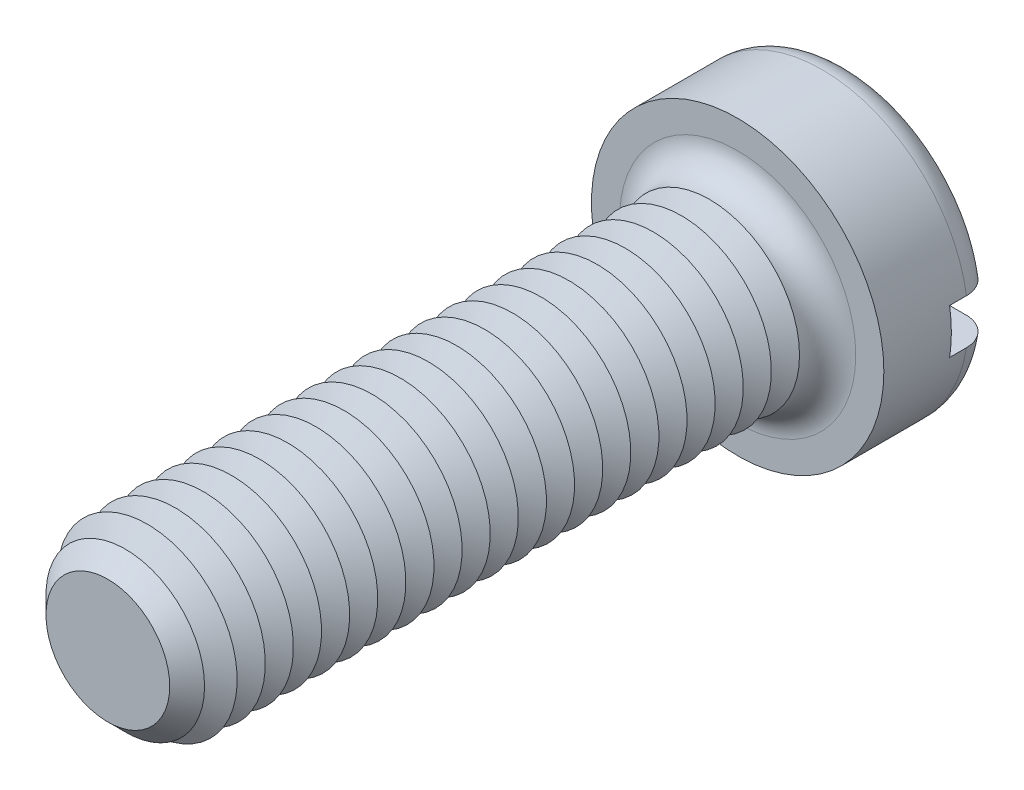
SolidWorks part; units mm, degrees
ref_plane "Front Plane" through (0, 0, 0) normal (0, 0, 1) x (1, 0, 0)
ref_plane "Top Plane" through (0, 0, 0) normal (0, 1, 0) x (1, 0, 0)
ref_plane "Right Plane" through (0, 0, 0) normal (1, 0, 0) x (0, 0, -1)
sketch "Sketch3" plane through (0, 0, 0) normal (0, 0, 1) x (1, 0, 0)
  circle A0 centre (0, 0) radius 6.5
  dimension "D1" = 13
extrude "Boss-Extrude2" add sketch "Sketch3" against normal blind 5
sketch "Sketch4" plane through (0, 0, 0) normal (0, 0, 1) x (1, 0, 0)
  circle A0 centre (0, 0) radius 4
  dimension "D1" = 8
extrude "Boss-Extrude3" add sketch "Sketch4" along normal blind 28
fillet "Fillet1" radius 1.25 2 edges at (6.5, 0, -5) (4, 0, 0)
chamfer "Chamfer1" distance 1.25 angle 45 1 edges at (4, 0, 28)
sketch "Sketch5" plane through (0, 0, 0) normal (1, 0, 0) x (0, 0, -1)
  line L0 (1.6944, 0) -> (-7.6738, 0) construction
sketch "Sketch6" plane through (0, 0, 0) normal (1, 0, 0) x (0, 0, -1)
  line L0 (-1.25, 4) -> (-1.875, 2.9175)
  line L1 (-1.875, 2.9175) -> (-2.5, 4)
  line L2 (-1.25, 4) -> (-26.75, 4) construction
  line L3 (-2.5, 4) -> (-1.25, 4)
  dimension "D1" = 1.25
revolve "Cut-Revolve1" cut sketch "Sketch6" angle 360 about L0
pattern_linear "LPattern1" count 21 spacing 1.25 along (0, 0, 1) of "Cut-Revolve1"
sketch "Sketch8" plane through (0, 0, -5) normal (0, 0, -1) x (-1, 0, 0)
  line L1 (6.5, -1) -> (-6.5, -1)
  line L2 (6.5, -1) -> (6.5, 1)
  line L3 (6.5, 1) -> (-6.5, 1)
  line L4 (-6.5, -1) -> (-6.5, 1)
  line L5 (6.5, -1) -> (-6.5, 1) construction
  line L6 (6.5, 1) -> (-6.5, -1) construction
  point P0 (0, 0)
  dimension "D1" = 13
  dimension "D2" = 2
extrude "Cut-Extrude1" cut sketch "Sketch8" against normal blind 2
